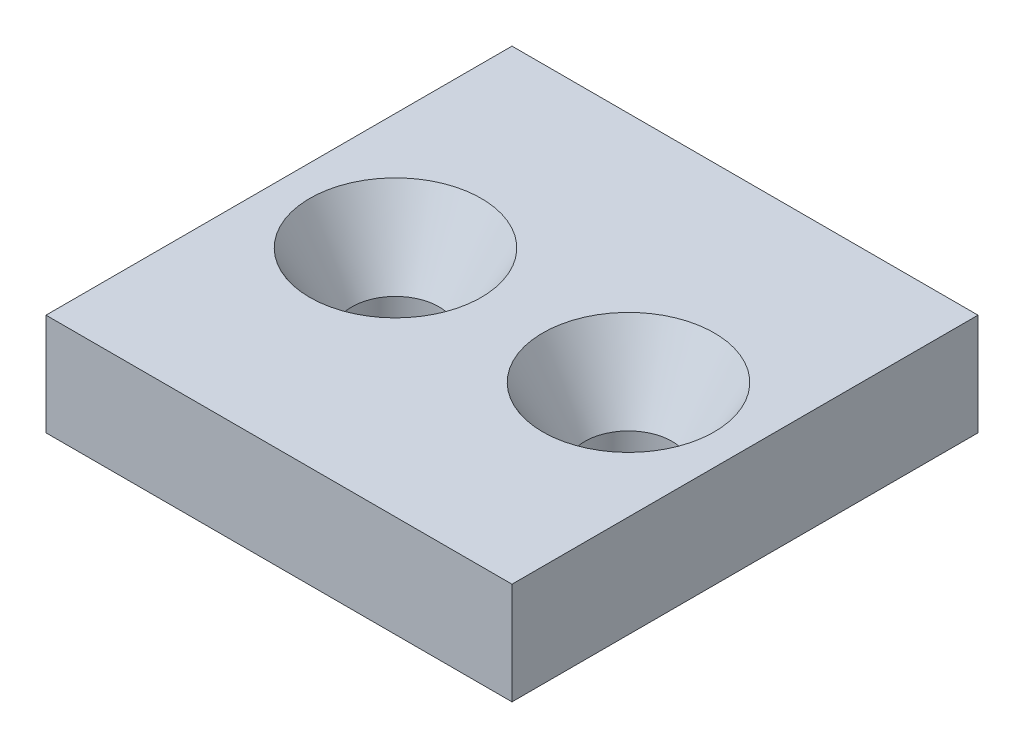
SolidWorks part; units mm, degrees
ref_plane "Front Plane" through (0, 0, 0) normal (0, 0, 1) x (1, 0, 0)
ref_plane "Top Plane" through (0, 0, 0) normal (0, 1, 0) x (1, 0, 0)
ref_plane "Right Plane" through (0, 0, 0) normal (1, 0, 0) x (0, 0, -1)
sketch "Sketch1" plane through (0, 0, 0) normal (0, 1, 0) x (1, 0, 0)
  line L1 (-16, -16) -> (16, -16)
  line L2 (-16, -16) -> (-16, 16)
  line L3 (-16, 16) -> (16, 16)
  line L4 (16, -16) -> (16, 16)
  line L5 (-16, -16) -> (16, 16) construction
  line L6 (-16, 16) -> (16, -16) construction
  point P0 (0, 0)
  dimension "D1" = 32
extrude "Boss-Extrude1" add sketch "Sketch1" along normal blind 7
hole_wizard "CSK for M1.6 Countersunk Flat Head Screw1" positions "Sketch3" profile "Sketch2" countersink size "M1.6" standard "ISO"
sketch "Sketch3" plane through (0, 7, 0) normal (0, 1, 0) x (-1, 0, 0)
  line L0 (-16, 16) -> (-16, -16) construction
  line L1 (-16, -16) -> (16, -16) construction
  point P0 (8, 0)
  point P1 (-8, 0)
  dimension "D1" = 8
  dimension "D2" = 16
  dimension "D3" = 16
sketch "Sketch2" plane through (-8, 7, 0) normal (1, 0, 0) x (0, 0, 1)
  line L0 (0, 0) -> (0, 7)
  line L1 (0, 7) -> (3, 7)
  line L2 (3, 7) -> (3, 5.0056)
  line L3 (3, 5.0056) -> (5.89, 0)
  line L5 (5.89, 0) -> (0, 0)
  line L6 (-3, 5.0056) -> (-5.89, 0) construction
  line L11 (0, -6.35) -> (0, 107.95) construction
  dimension "Thru Hole Dia." = 6
  dimension "Thru Hole Depth" = 7
  dimension "Near C'Sink Dia." = 11.78
  dimension "Near C'Sink Angle" = 60
